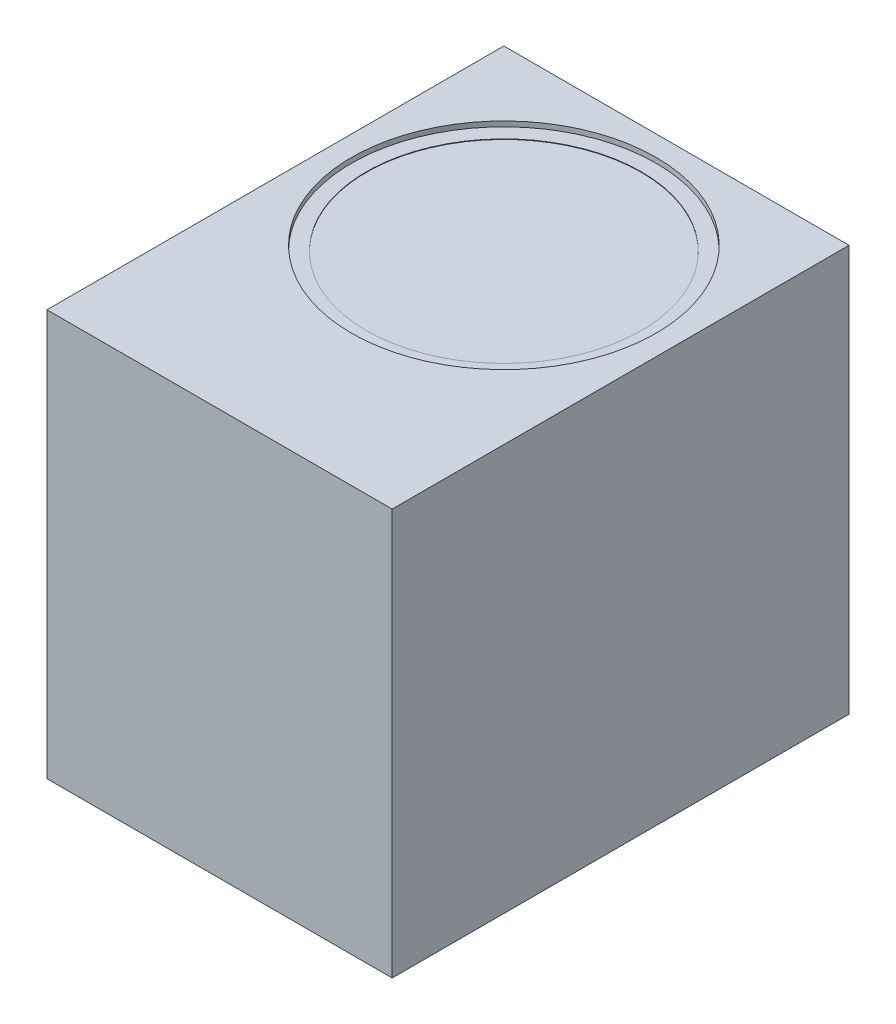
SolidWorks part; units mm, degrees
ref_plane "Alzado" through (0, 0, 0) normal (0, 0, 1) x (1, 0, 0)
ref_plane "Planta" through (0, 0, 0) normal (0, 1, 0) x (1, 0, 0)
ref_plane "Vista lateral" through (0, 0, 0) normal (1, 0, 0) x (0, 0, -1)
sketch "Croquis1" plane through (0, 0, 0) normal (0, 1, 0) x (1, 0, 0)
  line L0 (-34, 0) -> (-34, -56)
  line L1 (-34, -56) -> (34, -56)
  line L2 (34, -56) -> (34, 0)
  line L3 (-34, 0) -> (-34, 34)
  line L4 (-34, 34) -> (34, 34)
  line L5 (34, 34) -> (34, 0)
  dimension "D2" = 68
extrude "Saliente-Extruir1" add sketch "Croquis1" along normal blind 80
sketch "Croquis2" plane through (0, 80, 0) normal (0, 1, 0) x (1, 0, 0)
  circle A0 centre (0, 0) radius 30
extrude "Cortar-Extruir1" cut sketch "Croquis2" against normal blind 1
sketch "Croquis3" plane through (0, 79, 0) normal (0, 1, 0) x (1, 0, 0)
  circle A0 centre (0, 0) radius 27.0917
extrude "Cortar-Extruir2" cut sketch "Croquis3" against normal blind 0.1
